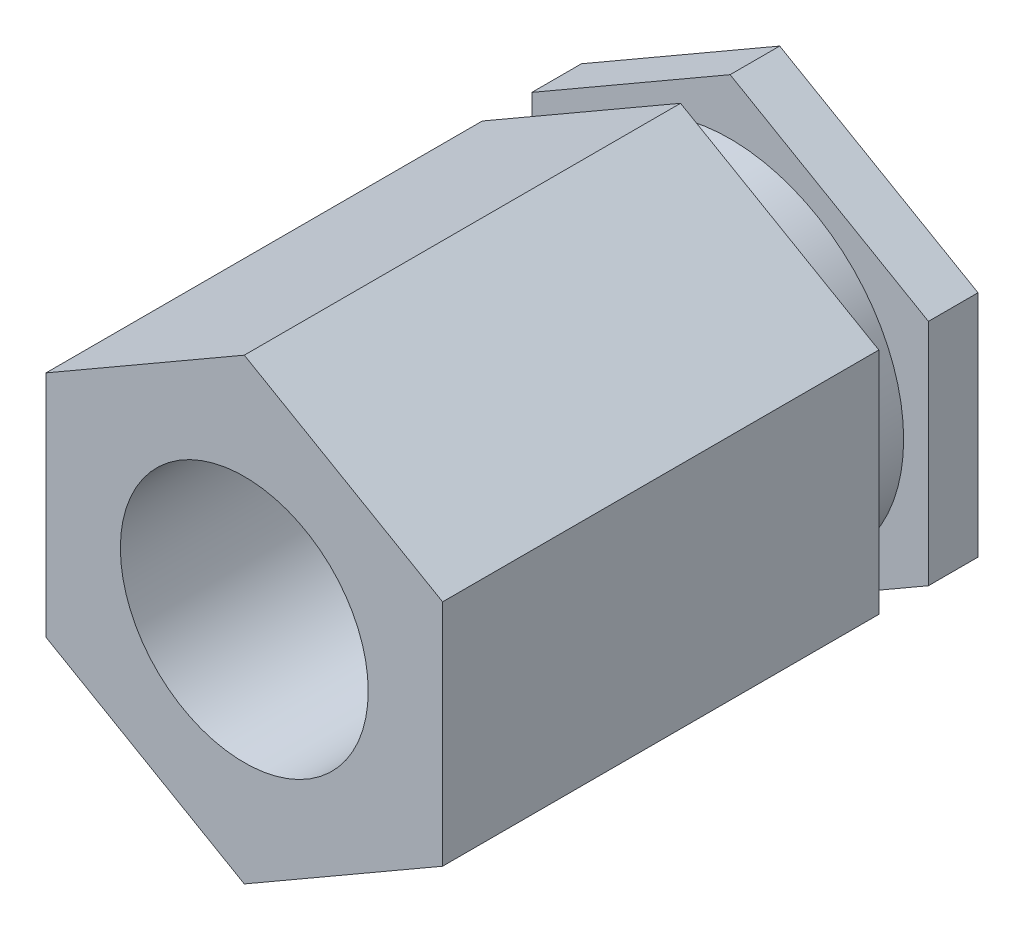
SolidWorks part; units mm, degrees
ref_plane "Face" through (0, 0, 0) normal (0, 0, 1) x (1, 0, 0)
ref_plane "Dessus" through (0, 0, 0) normal (0, 1, 0) x (1, 0, 0)
ref_plane "Droite" through (0, 0, 0) normal (1, 0, 0) x (0, 0, -1)
sketch "Esquisse1" plane through (0, 0, 0) normal (0, 0, 1) x (1, 0, 0)
  line L1 (0, 4.6188) -> (-4, 2.3094)
  line L2 (-4, 2.3094) -> (-4, -2.3094)
  line L3 (-4, -2.3094) -> (0, -4.6188)
  line L4 (0, -4.6188) -> (4, -2.3094)
  line L5 (4, -2.3094) -> (4, 2.3094)
  line L6 (4, 2.3094) -> (0, 4.6188)
  circle A0 centre (0, 0) radius 2.5
  circle A1 centre (0, 0) radius 4 construction
  dimension "D1" = 5
  dimension "D2" = 8
extrude "Base-Extrusion" add sketch "Esquisse1" against normal blind 10.8
sketch "Esquisse2" plane through (0, 0, 0) normal (1, 0, 0) x (0, 0, -1)
  line L0 (10.8, 2.3094) -> (10.8, 4.6188) construction
  line L1 (8.8, 5.381) -> (9.8, 5.381)
  line L2 (8.8, 5.381) -> (8.8, 3.5)
  line L3 (8.8, 3.5) -> (9.8, 3.5)
  line L4 (9.8, 5.381) -> (9.8, 3.5)
  line L5 (-0.5078, 0) -> (0.3561, 0) construction
  line L6 (10.8, 0) -> (0, 0) construction
  dimension "D1" = 1
  dimension "D2" = 1
  dimension "D3" = 3.5
revolve "Enlèvement de matière-Révolution1" cut sketch "Esquisse2" angle 360 about L5
